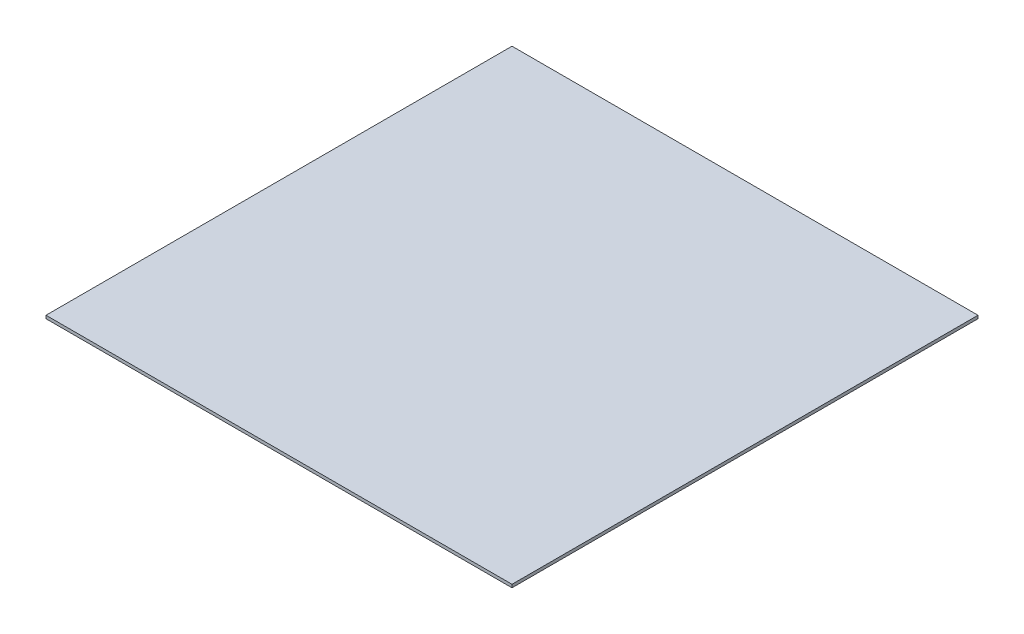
SolidWorks part; units mm, degrees
ref_plane "Front Plane" through (0, 0, 0) normal (0, 0, 1) x (1, 0, 0)
ref_plane "Top Plane" through (0, 0, 0) normal (0, 1, 0) x (1, 0, 0)
ref_plane "Right Plane" through (0, 0, 0) normal (1, 0, 0) x (0, 0, -1)
sketch "Sketch1" plane through (0, 0, 0) normal (0, 1, 0) x (1, 0, 0)
  line L1 (-304.8, -304.8) -> (304.8, -304.8)
  line L2 (-304.8, -304.8) -> (-304.8, 304.8)
  line L3 (-304.8, 304.8) -> (304.8, 304.8)
  line L4 (304.8, -304.8) -> (304.8, 304.8)
  line L5 (-304.8, -304.8) -> (304.8, 304.8) construction
  line L6 (-304.8, 304.8) -> (304.8, -304.8) construction
  point P0 (0, 0)
  dimension "D1" = 609.6
  dimension "D2" = 609.6
extrude "Boss-Extrude1" add sketch "Sketch1" along normal blind 4
